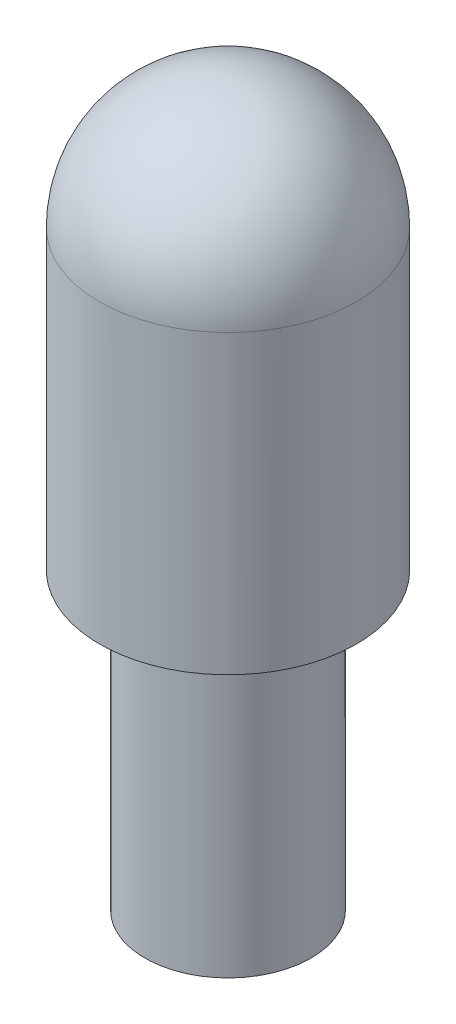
SolidWorks part; units mm, degrees
ref_plane "front" through (0, 0, 0) normal (0, 0, 1) x (1, 0, 0)
ref_plane "top" through (0, 0, 0) normal (0, 1, 0) x (1, 0, 0)
ref_plane "side" through (0, 0, 0) normal (1, 0, 0) x (0, 0, -1)
sketch "Sketch1" plane through (0, 0, 0) normal (0, 0, 1) x (1, 0, 0)
  line L0 (0, 0) -> (0, 58.4526) construction
  line L1 (0, -50) -> (0, 50) construction
  line L2 (0, 0) -> (1.2319, 0)
  line L3 (1.2319, 0) -> (1.2319, 4.3688)
  line L4 (1.2319, 4.3688) -> (1.905, 4.3688)
  line L5 (1.905, 4.3688) -> (1.905, 8.763)
  line L6 (1.905, 10.668) -> (0, 10.668) construction
  line L7 (0, 10.668) -> (0, 0)
  arc A0 (1.905, 8.763) -> (0, 10.668) centre (0, 8.763) ccw
  dimension "D1" = 2.4638
  dimension "D2" = 3.81
  dimension "D3" = 4.3688
  dimension "D4" = 10.668
revolve "Revolve1" add sketch "Sketch1" angle 360 about L0
fillet "Fillet1" radius 0.254 1 edges at (0, 4.3688, -1.2319)
